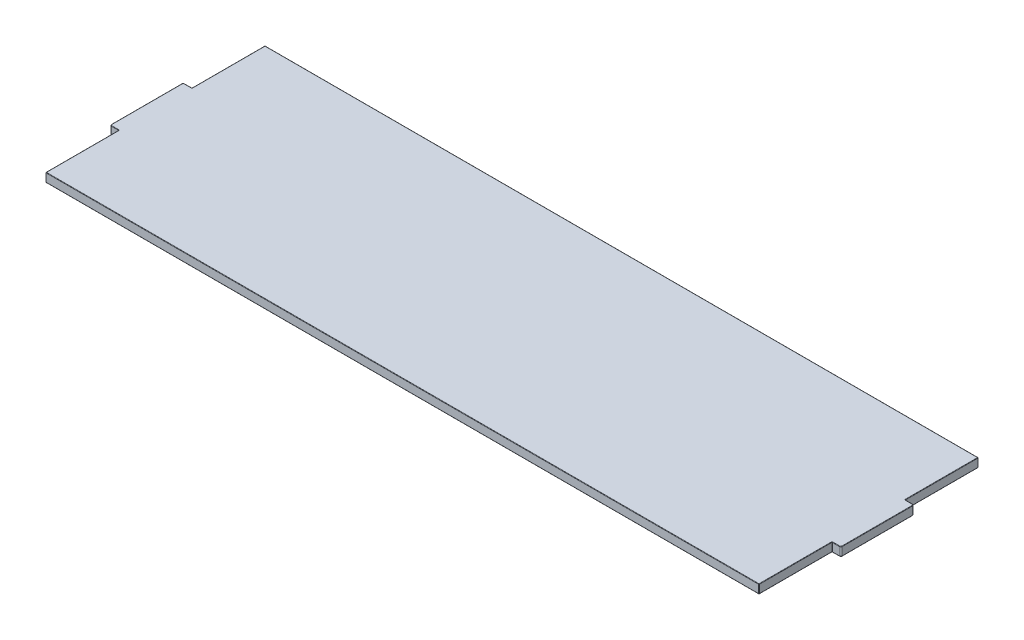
SolidWorks part; units mm, degrees
ref_plane "Front Plane" through (0, 0, 0) normal (0, 0, 1) x (1, 0, 0)
ref_plane "Top Plane" through (0, 0, 0) normal (0, 1, 0) x (1, 0, 0)
ref_plane "Right Plane" through (0, 0, 0) normal (1, 0, 0) x (0, 0, -1)
sketch "Sketch2" plane through (0, 0, 0) normal (0, 1, 0) x (1, 0, 0)
  line L0 (-500, 0) -> (-488, 0) construction
  line L1 (-488, 150) -> (488, 150)
  line L2 (-488, 150) -> (-488, 50)
  line L3 (-488, -150) -> (488, -150)
  line L4 (488, 150) -> (488, 50)
  line L5 (-488, 150) -> (488, -150) construction
  line L6 (-488, -150) -> (488, 150) construction
  line L7 (0, 466.5775) -> (0, -458.5561) construction
  line L8 (-500, 95.1814) -> (-500, -112.9246) construction
  line L9 (-500, 50) -> (-488, 50)
  line L10 (-500, -50) -> (-488, -50)
  line L11 (0, 0) -> (488, 0) construction
  line L12 (-500, 50) -> (-500, -50)
  line L13 (-488, -50) -> (-488, -150)
  line L14 (500, -50) -> (488, -50)
  line L15 (500, 50) -> (500, -50)
  line L16 (500, 50) -> (488, 50)
  line L17 (488, -50) -> (488, -150)
  line L18 (500, 0) -> (689.8396, 0) construction
  point P0 (0, 0)
  dimension "D1" = 976
  dimension "D2" = 300
  dimension "D3" = 12
  dimension "D4" = 50
extrude "Boss-Extrude1" add sketch "Sketch2" along normal blind 12
fillet "Fillet1" radius 2 4 edges at (-500, 6, -50) (-500, 6, 50) (500, 6, -50) (500, 6, 50)
fillet "Fillet2" radius 0.5 40 edges at (-488, 6, 50) (-488, 6, -50) (488, 6, 50) (488, 6, -50) (488, 6, -150) (-488, 6, -150) (-488, 6, 150) (488, 6, 150) (-499.4142, 0, 49.4142) (-493, 0, 50) (-488, 0, 100) (0, 0, 150) (488, 0, 100) (493, 0, 50) (499.4142, 0, 49.4142) (500, 0, 0) (499.4142, 0, -49.4142) (493, 0, -50) (488, 0, -100) (0, 0, -150) (-488, 0, -100) (-493, 0, -50) (-499.4142, 0, -49.4142) (-500, 0, 0) (-488, 12, -100) (0, 12, -150) (488, 12, -100) (493, 12, -50) (499.4142, 12, -49.4142) (500, 12, 0) (499.4142, 12, 49.4142) (493, 12, 50) (488, 12, 100) (0, 12, 150) (-488, 12, 100) (-493, 12, 50) (-499.4142, 12, 49.4142) (-500, 12, 0) (-499.4142, 12, -49.4142) (-493, 12, -50)
